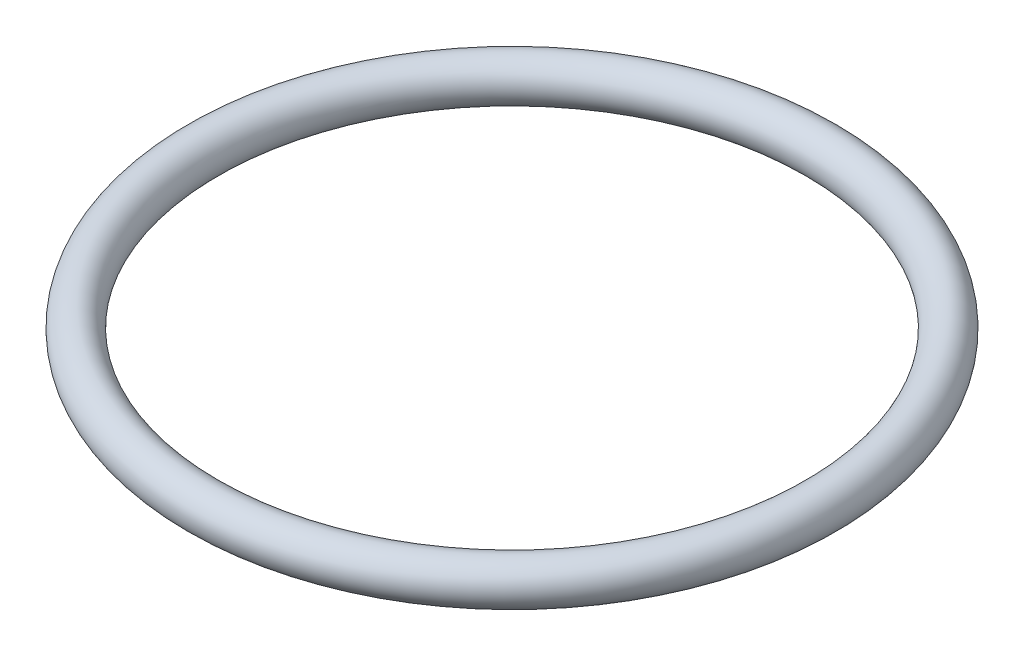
SolidWorks part; units mm, degrees
ref_plane "Front" through (0, 0, 0) normal (0, 0, 1) x (1, 0, 0)
ref_plane "Top" through (0, 0, 0) normal (0, 1, 0) x (1, 0, 0)
ref_plane "Right" through (0, 0, 0) normal (1, 0, 0) x (0, 0, -1)
sketch "Sketch3" plane through (0, 0, 0) normal (1, 0, 0) x (0, 0, -1)
  line L0 (0, 0) -> (0, 32.7991) construction
  circle A0 centre (-12.2682, 0.8382) radius 0.8382
  dimension "D3" = 1.6764
  dimension "D1" = 0.8382
  dimension "D2" = 24.5364
revolve "Revolve1" add sketch "Sketch3" angle 360 about L0
